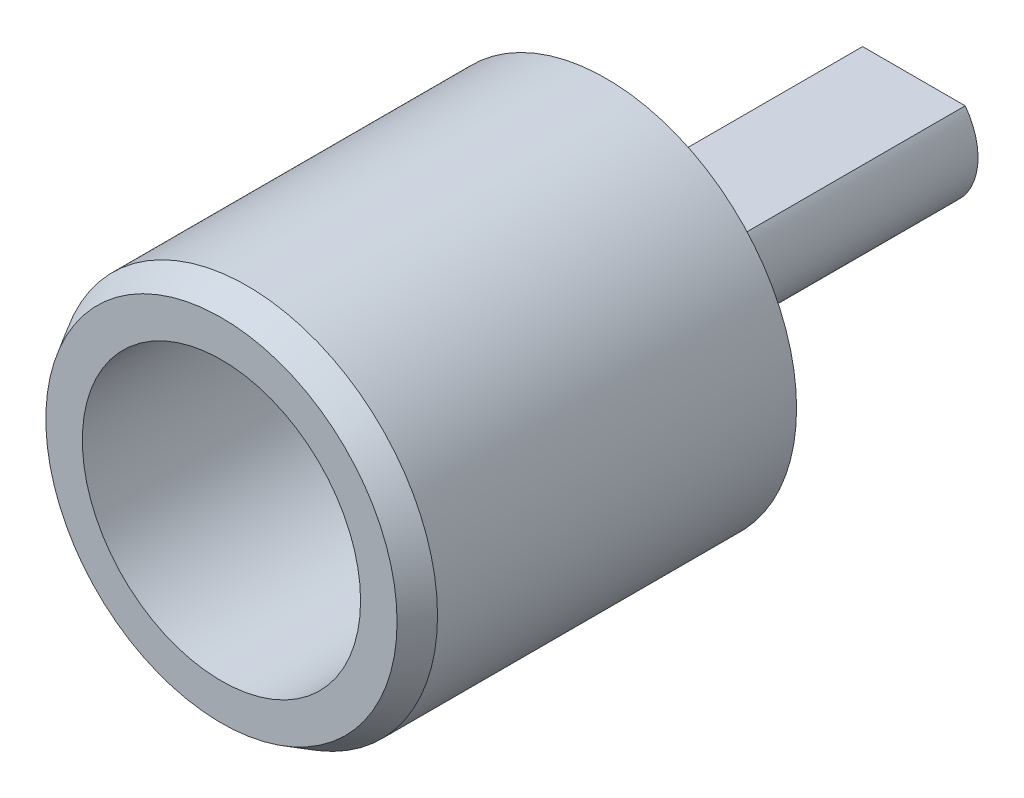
SolidWorks part; units mm, degrees
ref_plane "Front Plane" through (0, 0, 0) normal (0, 0, 1) x (1, 0, 0)
ref_plane "Top Plane" through (0, 0, 0) normal (0, 1, 0) x (1, 0, 0)
ref_plane "Right Plane" through (0, 0, 0) normal (1, 0, 0) x (0, 0, -1)
sketch "Sketch1" plane through (0, 0, 0) normal (0, 0, 1) x (1, 0, 0)
  line L0 (-2, 1.5) -> (2, 1.5)
  arc A0 (-2, 1.5) -> (2, 1.5) centre (0, 0) ccw
  dimension "D1" = 5
  dimension "D2" = 4
extrude "Boss-Extrude1" add sketch "Sketch1" against normal blind 12
sketch "Sketch4" plane through (0, 0, 0) normal (0, 0, 1) x (1, 0, 0)
  circle A0 centre (0, 0) radius 7.425
  dimension "D1" = 14.85
extrude "Boss-Extrude2" add sketch "Sketch4" along normal blind 15
sketch "Sketch7" plane through (0, 0, 15) normal (0, 0, 1) x (1, 0, 0)
  circle A2 centre (0, 0) radius 5.425
  circle A3 centre (0, 0) radius 5.425
  dimension "D1" = 2
extrude "Cut-Extrude2" cut sketch "Sketch7" against normal blind 14.5
chamfer "Chamfer3" distance 1 angle 30 1 edges at (7.425, 0, 15)
